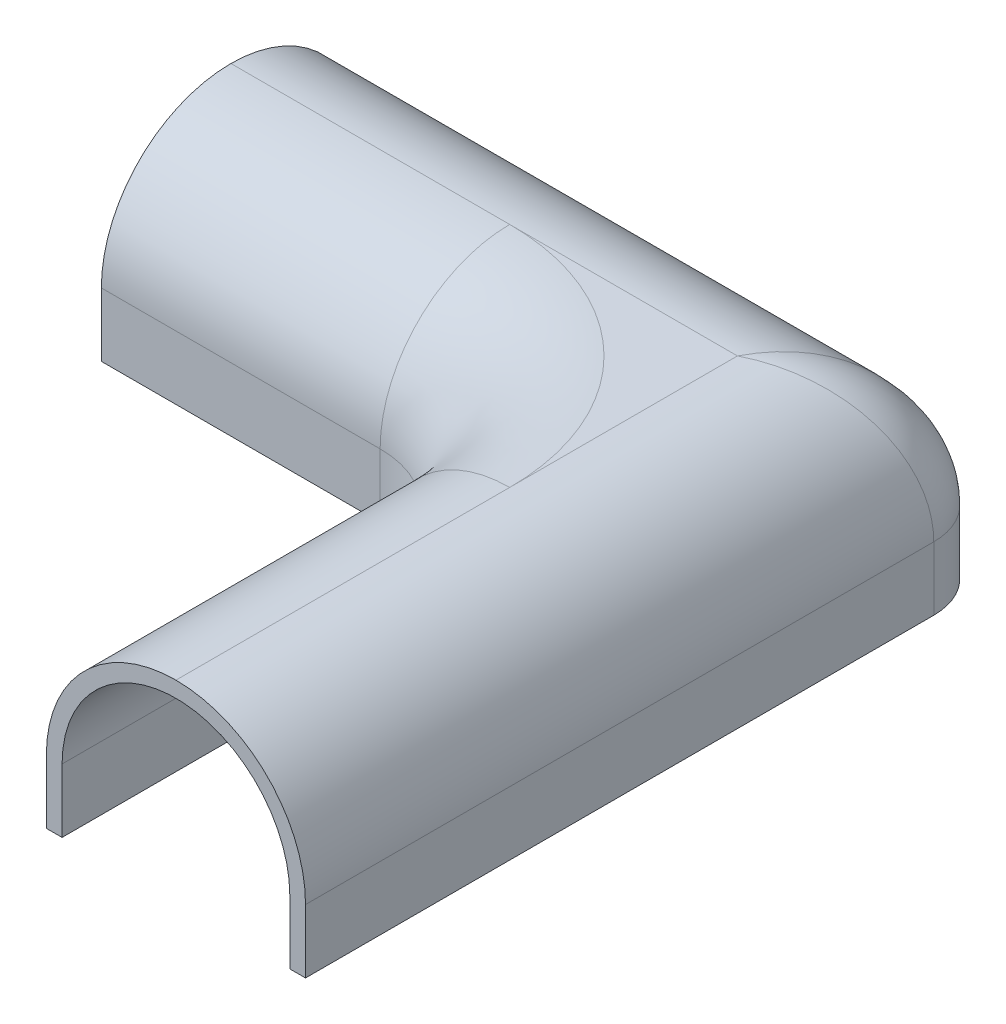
SolidWorks part; units mm, degrees
ref_plane "Plan de face" through (0, 0, 0) normal (0, 0, 1) x (1, 0, 0)
ref_plane "Plan de dessus" through (0, 0, 0) normal (0, 1, 0) x (1, 0, 0)
ref_plane "Plan de droite" through (0, 0, 0) normal (1, 0, 0) x (0, 0, -1)
sketch "Esquisse1" plane through (0, 0, 0) normal (0, 1, 0) x (1, 0, 0)
  line L0 (-32.25, 8.25) -> (8.25, 8.25)
  line L1 (8.25, 8.25) -> (8.25, -35.75)
  line L2 (-8.25, -35.75) -> (8.25, -35.75)
  line L3 (-8.25, -35.75) -> (-8.25, -8.25)
  line L4 (-8.25, -8.25) -> (-32.25, -8.25)
  line L5 (-32.25, 8.25) -> (-32.25, -8.25)
  dimension "D1" = 16.5
  dimension "D2" = 8.25
  dimension "D3" = 16.5
  dimension "D4" = 8.25
  dimension "D5" = 32.25
  dimension "D6" = 35.75
extrude "Extrusion1" add sketch "Esquisse1" along normal blind 12.3
shell "Coque1" thickness 1
fillet "Congé4" radius 6.25 1 edges at (-8.25, 6.15, 8.25)
fillet "Congé5" radius 7.25 1 edges at (-7.25, 5.65, 7.25)
fillet "Congé6" radius 3 1 edges at (7.25, 5.65, -7.25)
fillet "Congé7" radius 4 1 edges at (8.25, 6.15, -8.25)
fillet "Congé8" radius 7.25 6 edges at (-22.875, 11.3, 7.25) (-9.3735, 11.3, 9.3735) (7.25, 11.3, 15.25) (6.3713, 11.3, -6.3713) (-7.25, 11.3, 24.625) (-13.5, 11.3, -7.25)
fillet "Congé9" radius 8.25 6 edges at (8.25, 12.3, 15.75) (7.0784, 12.3, -7.0784) (-8.25, 12.3, 25.125) (-10.0806, 12.3, 10.0806) (-14, 12.3, -8.25) (-23.375, 12.3, 8.25)
sketch "Esquisse2" plane through (0, 0, 35.75) normal (0, 0, 1) x (1, 0, 0)
  line L0 (-7.25, 4.05) -> (-7.25, 0)
  line L1 (7.25, 4.05) -> (7.25, 0)
  line L2 (-7.25, 0) -> (7.25, 0)
  arc A0 (-7.25, 4.05) -> (7.25, 4.05) centre (0, 4.05) cw
extrude "Enlèv. mat.-Extru.1" cut sketch "Esquisse2" against normal blind 1
